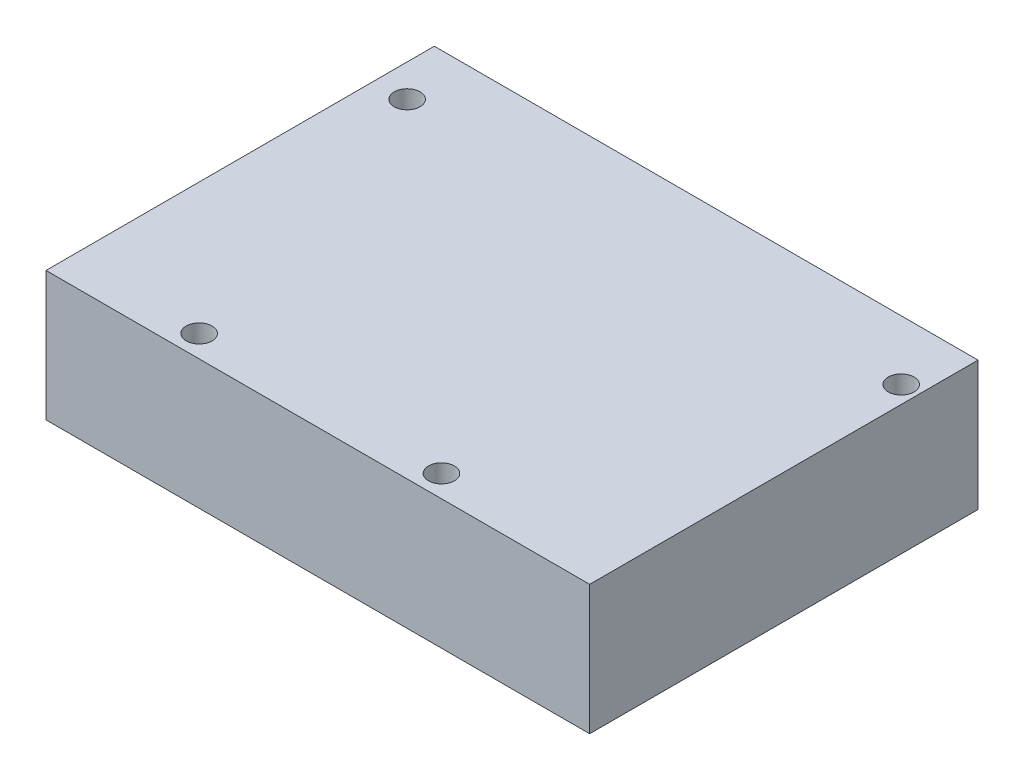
SolidWorks part; units mm, degrees
ref_plane "前视基准面" through (0, 0, 0) normal (0, 0, 1) x (1, 0, 0)
ref_plane "上视基准面" through (0, 0, 0) normal (0, 1, 0) x (1, 0, 0)
ref_plane "右视基准面" through (0, 0, 0) normal (1, 0, 0) x (0, 0, -1)
sketch "草图1" plane through (0, 0, 0) normal (0, 1, 0) x (1, 0, 0)
  line L1 (-8.5, 7.5) -> (12.5, 7.5)
  line L2 (-8.5, 7.5) -> (-8.5, -7.5)
  line L3 (-8.5, -7.5) -> (12.5, -7.5)
  line L4 (12.5, 7.5) -> (12.5, -7.5)
extrude "凸台-拉伸1" add sketch "草图1" against normal blind 5
sketch "草图2" plane through (0, 0, 0) normal (0, 1, 0) x (1, 0, 0)
  circle A0 centre (-7.25, 5.2) radius 0.5
  circle A1 centre (11.8313, 5.2) radius 0.5
  circle A2 centre (5.9262, -6.6511) radius 0.5
  circle A3 centre (-3.4339, -6.6511) radius 0.5
extrude "切除-拉伸1" cut sketch "草图2" against normal blind 5
